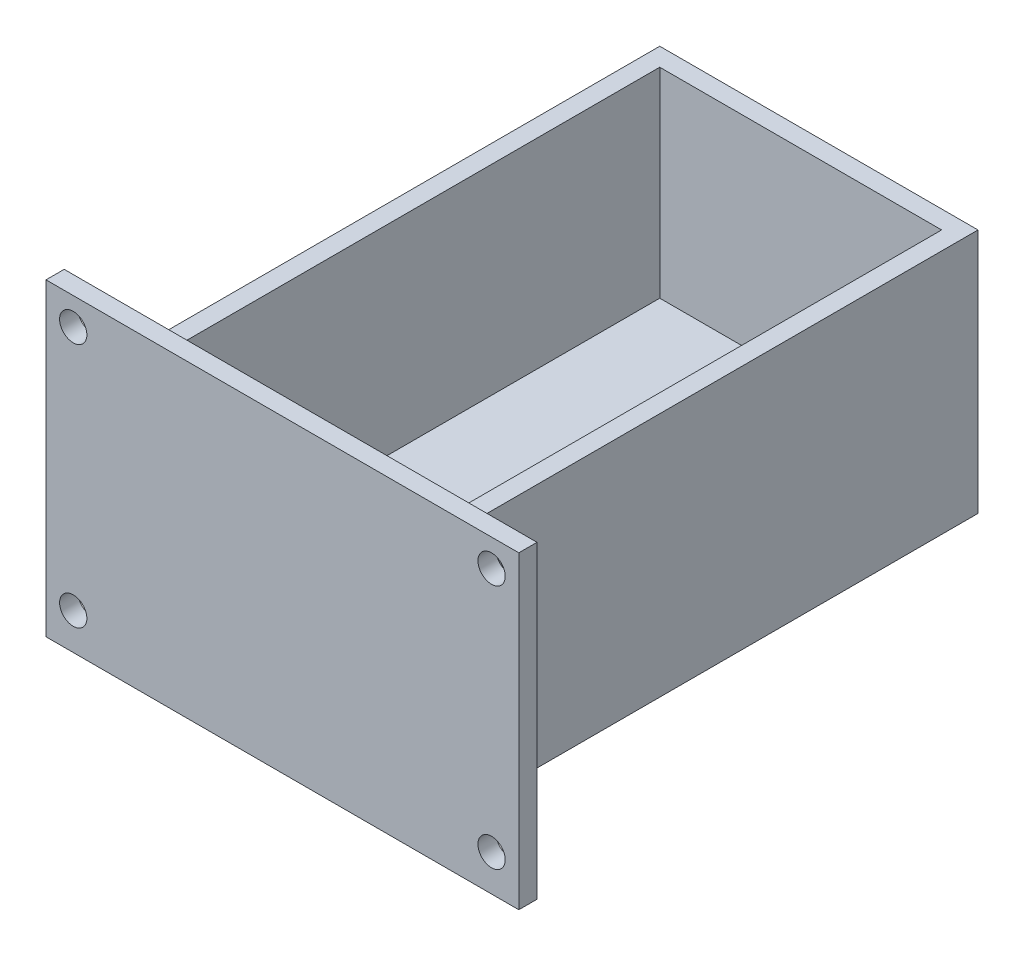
SolidWorks part; units mm, degrees
ref_plane "Front Plane" through (0, 0, 0) normal (0, 0, 1) x (1, 0, 0)
ref_plane "Top Plane" through (0, 0, 0) normal (0, 1, 0) x (1, 0, 0)
ref_plane "Right Plane" through (0, 0, 0) normal (1, 0, 0) x (0, 0, -1)
sketch "Sketch1" plane through (0, 0, 0) normal (0, 0, 1) x (1, 0, 0)
  line L1 (-17.5, 15) -> (17.5, 15)
  line L2 (-17.5, 15) -> (-17.5, -15)
  line L3 (-17.5, -15) -> (17.5, -15)
  line L4 (17.5, 15) -> (17.5, -15)
  line L5 (-17.5, 15) -> (17.5, -15) construction
  line L6 (-17.5, -15) -> (17.5, 15) construction
  point P0 (0, 0)
  dimension "D1" = 30
  dimension "D2" = 35
extrude "Boss-Extrude1" add sketch "Sketch1" against normal blind 57
sketch "Sketch2" plane through (0, 0, 0) normal (0, 0, 1) x (1, 0, 0)
  line L0 (17.5, 15) -> (-17.5, 15) construction
  line L1 (-26, 18) -> (26, 18)
  line L2 (-26, 18) -> (-26, -18)
  line L3 (-26, -18) -> (26, -18)
  line L4 (26, 18) -> (26, -18)
  line L5 (-26, 18) -> (26, -18) construction
  line L6 (-26, -18) -> (26, 18) construction
  point P0 (0, 0)
  dimension "D1" = 52
  dimension "D2" = 3
extrude "Boss-Extrude2" add sketch "Sketch2" along normal blind 2
sketch "Sketch3" plane through (0, 15, 0) normal (0, 1, 0) x (1, 0, 0)
  line L0 (17.5, 57) -> (-17.5, 57) construction
  line L1 (17.5, 0) -> (-17.5, 0) construction
  line L2 (-15.5, 55) -> (-15.5, 2)
  line L3 (-15.5, 2) -> (15.5, 2)
  line L4 (15.5, 55) -> (15.5, 2)
  line L5 (-15.5, 55) -> (15.5, 55)
  line L7 (-17.5, 57) -> (-17.5, 0) construction
  line L8 (17.5, 57) -> (17.5, 0) construction
  line L9 (-17.5, 57) -> (17.5, 57)
  line L10 (-17.5, 57) -> (-17.5, 0)
  line L11 (-17.5, 0) -> (17.5, 0)
  line L12 (17.5, 57) -> (17.5, 0)
  dimension "D1" = 2
extrude "Cut-Extrude1" cut sketch "Sketch3" against normal blind 22 contours L2 L3 L4 L5
sketch "Sketch5" plane through (0, -15, 0) normal (0, -1, 0) x (1, 0, 0)
  line L0 (-17.5, 0) -> (-17.5, -57)
  line L1 (-17.5, -57) -> (17.5, -57)
  line L2 (17.5, -57) -> (17.5, 0)
  line L3 (17.5, 0) -> (-17.5, 0)
extrude "Cut-Extrude3" cut sketch "Sketch5" against normal blind 3
sketch "Sketch6" plane through (0, 0, 2) normal (0, 0, 1) x (1, 0, 0)
  line L0 (-26, -18) -> (-26, -16)
  line L1 (-26, 18) -> (-26, -18) construction
  line L2 (-26, -16) -> (26, -16)
  line L3 (26, -18) -> (26, 18) construction
  line L4 (26, -16) -> (26, -18)
  line L5 (26, -18) -> (-26, -18)
  dimension "D1" = 2
extrude "Cut-Extrude4" cut sketch "Sketch6" against normal through all
sketch "Sketch9" plane through (0, 0, 2) normal (0, 0, 1) x (1, 0, 0)
  line L0 (-26, -16) -> (-26, 18)
  line L1 (-26, 18) -> (26, 18)
  line L2 (26, 18) -> (26, -16)
  line L3 (26, -16) -> (-26, -16)
extrude "Boss-Extrude3" add sketch "Sketch9" against normal blind 2
sketch "Sketch11" plane through (0, 0, 2) normal (0, 0, 1) x (1, 0, 0)
  line L1 (0, 0) -> (0, -50000) construction
  line L2 (26, 18) -> (-26, 18) construction
  line L3 (-26, 18) -> (-26, -16) construction
  circle A0 centre (-23.0044, 15) radius 1.5
  circle A1 centre (-23.0044, -12) radius 1.5
  circle A2 centre (23.0044, 15) radius 1.5
  circle A3 centre (23.0044, -12) radius 1.5
  dimension "D1" = 3
  dimension "D2" = 3
  dimension "D3" = 2.9956
  dimension "D4" = 27
extrude "Cut-Extrude6" cut sketch "Sketch11" against normal blind 27
